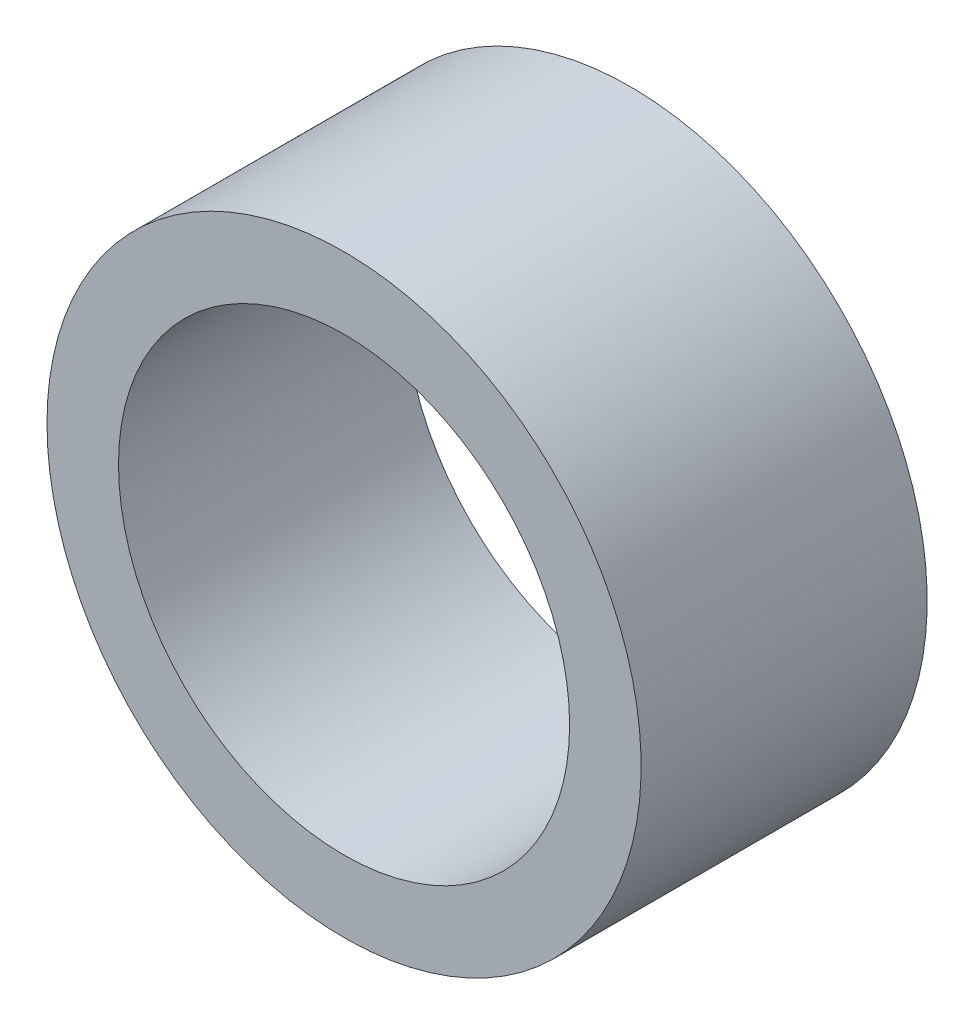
SolidWorks part; units mm, degrees
ref_plane "Face" through (0, 0, 0) normal (0, 0, 1) x (1, 0, 0)
ref_plane "Dessus" through (0, 0, 0) normal (0, 1, 0) x (1, 0, 0)
ref_plane "Droite" through (0, 0, 0) normal (1, 0, 0) x (0, 0, -1)
sketch "Esquisse1" plane through (0, 0, 0) normal (0, 0, 1) x (1, 0, 0)
  circle A0 centre (0, 0) radius 10.25
  circle A1 centre (0, 0) radius 13.5
  dimension "D1" = 20.5
  dimension "D2" = 27
extrude "Base-Extrusion" add sketch "Esquisse1" along normal blind 13
